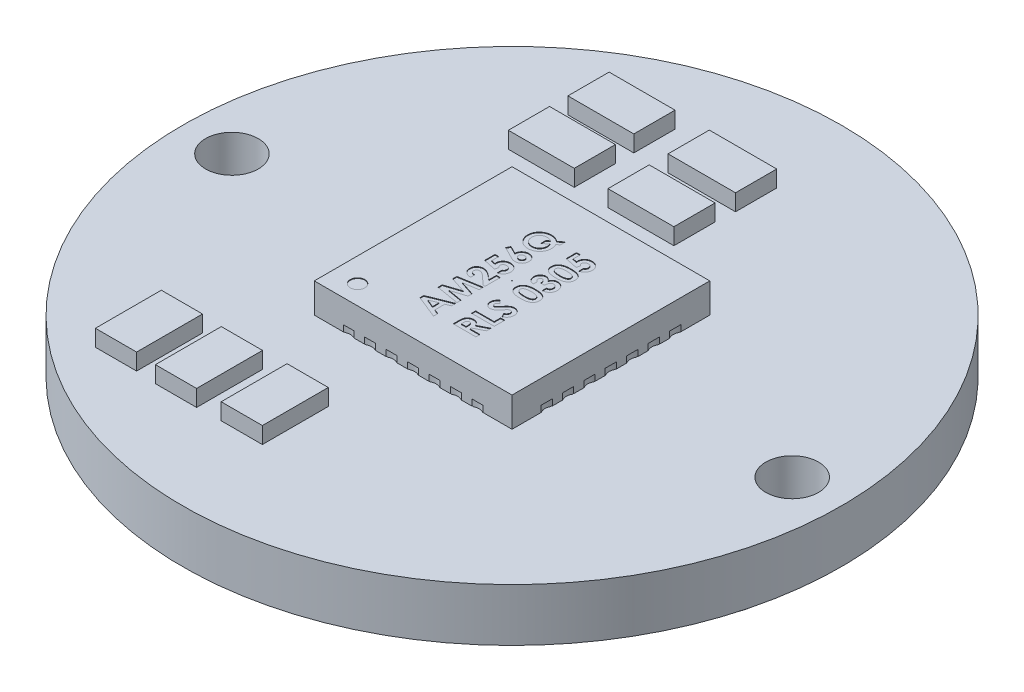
SolidWorks part; units mm, degrees
ref_plane "Plane1" through (0, 0, 0) normal (0, 0, 1) x (1, 0, 0)
ref_plane "Plane2" through (0, 0, 0) normal (0, 1, 0) x (1, 0, 0)
ref_plane "Plane3" through (0, 0, 0) normal (1, 0, 0) x (0, 0, -1)
sketch "Sketch1" plane through (0, 0, 0) normal (0, 1, 0) x (1, 0, 0)
  line L0 (0, 6) -> (6, 0) construction
  line L1 (0, 0) -> (6, 0)
  line L2 (0, 0) -> (0, 6)
  line L3 (0, 6) -> (6, 6)
  line L4 (6, 0) -> (6, 6)
  line L5 (6, 6) -> (0, 0) construction
  circle A0 centre (3, 3) radius 0.0106
  dimension "D1" = 6
  dimension "D2" = 6
extrude "Base-Extrude" add sketch "Sketch1" along normal blind 0.9
sketch "Sketch2" plane through (0, 0, 0) normal (0, -1, 0) x (1, 0, 0)
  line L0 (0.8008, -0.8) -> (5.2008, -0.8)
  line L1 (5.2008, -0.8) -> (5.2008, -5.2)
  line L2 (5.2008, -5.2) -> (0.8008, -5.2)
  line L3 (0.8008, -5.2) -> (0.8008, -0.8)
  line L4 (6, 0) -> (6, -6) construction
  line L5 (0, 0) -> (6, 0) construction
  line L6 (0.0008, -3.5) -> (0.5008, -3.5)
  line L7 (0.5008, -3.5) -> (0.5008, -3.8)
  line L8 (0.5008, -3.8) -> (0.0008, -3.8)
  line L9 (0.0008, -3.8) -> (0.0008, -3.5)
  line L11 (1.8508, -6) -> (1.8508, -5.5)
  line L12 (1.8508, -5.5) -> (1.5508, -5.5)
  line L13 (1.5508, -5.5) -> (1.5508, -6)
  line L14 (1.5508, -6) -> (1.8508, -6)
  line L15 (1.2008, -6) -> (1.2008, -5.5)
  line L16 (1.2008, -5.5) -> (0.9008, -5.5)
  line L17 (0.9008, -5.5) -> (0.9008, -6)
  line L18 (0.9008, -6) -> (1.2008, -6)
  line L19 (0.0008, -4.8) -> (0.5008, -4.8)
  line L20 (0.5008, -4.8) -> (0.5008, -5.1)
  line L21 (0.5008, -5.1) -> (0.0008, -5.1)
  line L22 (0.0008, -5.1) -> (0.0008, -4.8)
  line L23 (0.0008, -4.15) -> (0.5008, -4.15)
  line L24 (0.5008, -4.15) -> (0.5008, -4.45)
  line L25 (0.5008, -4.45) -> (0.0008, -4.45)
  line L26 (0.0008, -4.45) -> (0.0008, -4.15)
  line L27 (5.47, -0.1167) -> (5.87, -0.1167)
  line L28 (5.87, -0.1167) -> (5.87, -0.5167)
  line L29 (5.87, -0.5167) -> (5.47, -0.5167)
  line L30 (5.47, -0.5167) -> (5.47, -0.1167)
  line L31 (0.9008, 0) -> (1.2008, 0)
  line L32 (0.9008, -0.5) -> (0.9008, 0)
  line L33 (1.2008, 0) -> (1.2008, -0.5)
  line L34 (1.2008, -0.5) -> (0.9008, -0.5)
  line L35 (1.5508, 0) -> (1.8508, 0)
  line L36 (1.5508, -0.5) -> (1.5508, 0)
  line L37 (1.8508, 0) -> (1.8508, -0.5)
  line L38 (1.8508, -0.5) -> (1.5508, -0.5)
  line L39 (0.0008, -0.9) -> (0.5008, -0.9)
  line L40 (0.5008, -0.9) -> (0.5008, -1.2)
  line L41 (0.5008, -1.2) -> (0.0008, -1.2)
  line L42 (0.0008, -1.2) -> (0.0008, -0.9)
  line L43 (0.0008, -1.55) -> (0.5008, -1.55)
  line L44 (0.5008, -1.55) -> (0.5008, -1.85)
  line L45 (0.5008, -1.85) -> (0.0008, -1.85)
  line L46 (0.0008, -1.85) -> (0.0008, -1.55)
  line L47 (0.0008, -2.2) -> (0.5008, -2.2)
  line L48 (0.5008, -2.2) -> (0.5008, -2.5)
  line L49 (0.5008, -2.5) -> (0.0008, -2.5)
  line L50 (0.0008, -2.5) -> (0.0008, -2.2)
  line L51 (0.0008, -2.85) -> (0.5008, -2.85)
  line L52 (0.5008, -2.85) -> (0.5008, -3.15)
  line L53 (0.5008, -3.15) -> (0.0008, -3.15)
  line L54 (0.0008, -3.15) -> (0.0008, -2.85)
  line L55 (5.5008, -3.5) -> (5.5008, -3.8)
  line L56 (6.0008, -3.8) -> (6.0008, -3.5)
  line L58 (5.5008, -3.8) -> (6.0008, -3.8)
  line L59 (5.5008, -4.15) -> (5.5008, -4.45)
  line L60 (6.0008, -4.15) -> (5.5008, -4.15)
  line L61 (5.5008, -4.45) -> (6.0008, -4.45)
  line L62 (6.0008, -4.45) -> (6.0008, -4.15)
  line L63 (5.5008, -4.8) -> (5.5008, -5.1)
  line L64 (6.0008, -4.8) -> (5.5008, -4.8)
  line L65 (5.5008, -5.1) -> (6.0008, -5.1)
  line L66 (6.0008, -5.1) -> (6.0008, -4.8)
  line L67 (3.8008, -6) -> (3.8008, -5.5)
  line L68 (3.8008, -5.5) -> (3.5008, -5.5)
  line L69 (3.5008, -5.5) -> (3.5008, -6)
  line L70 (3.5008, -6) -> (3.8008, -6)
  line L71 (4.4508, -6) -> (4.4508, -5.5)
  line L72 (4.4508, -5.5) -> (4.1508, -5.5)
  line L73 (4.1508, -5.5) -> (4.1508, -6)
  line L74 (4.1508, -6) -> (4.4508, -6)
  line L75 (5.1008, -6) -> (5.1008, -5.5)
  line L76 (5.1008, -5.5) -> (4.8008, -5.5)
  line L77 (4.8008, -5.5) -> (4.8008, -6)
  line L78 (4.8008, -6) -> (5.1008, -6)
  line L79 (3.1508, -6) -> (3.1508, -5.5)
  line L80 (3.1508, -5.5) -> (2.8508, -5.5)
  line L81 (2.8508, -5.5) -> (2.8508, -6)
  line L82 (2.8508, -6) -> (3.1508, -6)
  line L83 (2.5008, -6) -> (2.5008, -5.5)
  line L84 (2.5008, -5.5) -> (2.2008, -5.5)
  line L85 (2.2008, -5.5) -> (2.2008, -6)
  line L86 (2.2008, -6) -> (2.5008, -6)
  line L87 (6.0008, -0.9) -> (5.5008, -0.9)
  line L88 (6.0008, -3.15) -> (6.0008, -2.85)
  line L89 (5.5008, -3.15) -> (6.0008, -3.15)
  line L90 (6.0008, -2.85) -> (5.5008, -2.85)
  line L91 (5.5008, -2.85) -> (5.5008, -3.15)
  line L92 (5.5008, -2.2) -> (5.5008, -2.5)
  line L93 (6.0008, -2.2) -> (5.5008, -2.2)
  line L94 (5.5008, -2.5) -> (6.0008, -2.5)
  line L95 (6.0008, -2.5) -> (6.0008, -2.2)
  line L96 (5.5008, -1.55) -> (5.5008, -1.85)
  line L97 (6.0008, -1.55) -> (5.5008, -1.55)
  line L98 (5.5008, -1.85) -> (6.0008, -1.85)
  line L99 (6.0008, -1.85) -> (6.0008, -1.55)
  line L100 (5.5008, -1.2) -> (6.0008, -1.2)
  line L101 (6.0008, -3.5) -> (5.5008, -3.5)
  line L102 (5.5008, -0.9) -> (5.5008, -1.2)
  line L103 (6.0008, -1.2) -> (6.0008, -0.9)
  line L104 (2.2008, 0) -> (2.5008, 0)
  line L105 (2.2008, -0.5) -> (2.2008, 0)
  line L106 (2.5008, 0) -> (2.5008, -0.5)
  line L107 (2.5008, -0.5) -> (2.2008, -0.5)
  line L108 (4.8008, 0) -> (5.1008, 0)
  line L109 (4.8008, -0.5) -> (4.8008, 0)
  line L110 (5.1008, 0) -> (5.1008, -0.5)
  line L111 (5.1008, -0.5) -> (4.8008, -0.5)
  line L112 (4.1508, 0) -> (4.4508, 0)
  line L113 (4.1508, -0.5) -> (4.1508, 0)
  line L114 (4.4508, 0) -> (4.4508, -0.5)
  line L115 (4.4508, -0.5) -> (4.1508, -0.5)
  line L116 (3.5008, 0) -> (3.8008, 0)
  line L117 (3.5008, -0.5) -> (3.5008, 0)
  line L118 (3.8008, 0) -> (3.8008, -0.5)
  line L119 (3.8008, -0.5) -> (3.5008, -0.5)
  line L120 (2.8508, -0.5) -> (2.8508, 0)
  line L121 (3.1508, 0) -> (3.1508, -0.5)
  line L122 (2.8508, 0) -> (3.1508, 0)
  line L123 (3.1508, -0.5) -> (2.8508, -0.5)
  circle A0 centre (3, -3) radius 0.005
  dimension "D2" = 3
  dimension "D3" = 0.01
  dimension "D1" = 3
extrude "Boss-Extrude1" add sketch "Sketch2" along normal blind 0.01
sketch "Sketch3" plane through (0, -0.01, 0) normal (0, -1, 0) x (1, 0, 0)
  line L3 (3.1508, 0) -> (3.5008, 0) construction
  circle A0 centre (4.9459, 0.25) radius 0.3
  circle A1 centre (4.2959, 0.25) radius 0.3
  circle A2 centre (3.6459, 0.25) radius 0.3
  circle A3 centre (2.9959, 0.25) radius 0.3
  circle A4 centre (2.3459, 0.25) radius 0.3
  circle A5 centre (1.6959, 0.25) radius 0.3
  circle A6 centre (1.0459, 0.25) radius 0.3
  circle A7 centre (4.9459, -6.25) radius 0.3
  circle A8 centre (4.2959, -6.25) radius 0.3
  circle A9 centre (3.6459, -6.25) radius 0.3
  circle A10 centre (2.9959, -6.25) radius 0.3
  circle A11 centre (2.3459, -6.25) radius 0.3
  circle A12 centre (1.6959, -6.25) radius 0.3
  circle A13 centre (1.0459, -6.25) radius 0.3
  circle A14 centre (-0.2541, -1.05) radius 0.3
  circle A15 centre (6.2459, -1.7) radius 0.3
  circle A16 centre (6.2459, -1.05) radius 0.3
  circle A17 centre (-0.2541, -1.7) radius 0.3
  circle A18 centre (6.2459, -2.35) radius 0.3
  circle A19 centre (-0.2541, -2.35) radius 0.3
  circle A20 centre (6.2459, -3) radius 0.3
  circle A21 centre (-0.2541, -3) radius 0.3
  circle A22 centre (6.2459, -3.65) radius 0.3
  circle A23 centre (-0.2541, -3.65) radius 0.3
  circle A24 centre (6.2459, -4.3) radius 0.3
  circle A25 centre (-0.2541, -4.3) radius 0.3
  circle A26 centre (6.2459, -4.95) radius 0.3
  circle A27 centre (-0.2541, -4.95) radius 0.3
  dimension "D1" = 0.6
  dimension "D2" = 0.25
extrude "Cut-Extrude1" cut sketch "Sketch3" against normal blind 0.2
sketch "Sketch4" plane through (0, 0.9, 0) normal (0, 1, 0) x (-1, 0, 0)
  line L0 (-2.7336, -0.3587) -> (-2.7336, -5.3322) construction
  text T0 "AM256Q  RLS 0305" font "Century Gothic" height 0.6879
extrude "Cut-Extrude2" cut sketch "Sketch4" against normal blind 0.02
sketch "Sketch5" plane through (0, 0.9, 0) normal (0, 1, 0) x (-1, 0, 0)
  circle A0 centre (-0.7301, -0.5825) radius 0.22
extrude "Cut-Extrude3" cut sketch "Sketch5" against normal blind 0.02
sketch "Sketch6" plane through (0, -0.01, 0) normal (0, -1, 0) x (1, 0, 0)
  line L0 (6, -5.1219) -> (6, -6) construction
  line L1 (4.5, -1.5) -> (1.5, -1.5)
  line L2 (4.5, -1.5) -> (4.5, -4.5)
  line L3 (4.5, -4.5) -> (1.5, -4.5)
  line L4 (1.5, -1.5) -> (1.5, -4.5)
  line L5 (0.8801, -6) -> (0, -6) construction
  dimension "D1" = 3
  dimension "D2" = 3
  dimension "D3" = 1.5
  dimension "D4" = 1.5
extrude "Cut-Extrude4" cut sketch "Sketch6" against normal blind 0.55
sketch "Sketch7" plane through (0, -0.01, 0) normal (0, -1, 0) x (1, 0, 0)
  line L1 (5.2008, -0.8) -> (0.8008, -0.8)
  line L2 (5.2008, -0.8) -> (5.2008, -5.2)
  line L3 (5.2008, -5.2) -> (0.8008, -5.2)
  line L4 (0.8008, -0.8) -> (0.8008, -5.2)
extrude "Boss-Extrude2" add sketch "Sketch7" against normal blind 0.3
sketch "Sketch9" plane through (0, -0.01, 0) normal (0, -1, 0) x (1, 0, 0)
  line L4 (0.8008, -0.8) -> (5.2008, -5.2) construction
  line L5 (5.2008, -0.8) -> (0.8008, -5.2) construction
  line L6 (3.0008, -3) -> (-5.4992, -3) construction
  line L7 (3.0008, -3) -> (11.5008, -3) construction
  circle A0 centre (3.0008, -3) radius 10
  circle A1 centre (-5.4992, -3) radius 0.8
  circle A2 centre (11.5008, -3) radius 0.8
  dimension "D2" = 8.5
  dimension "D3" = 8.5
  dimension "D4" = 1.6
  dimension "D5" = 1.6
extrude "Boss-Extrude3" add sketch "Sketch9" along normal blind 1.6
sketch "Sketch11" plane through (0, -1.61, 0) normal (0, -1, 0) x (1, 0, 0)
  line L0 (-5.4992, -0.75) -> (-5.4992, -5.25) construction
  line L1 (-4.3492, -0.75) -> (-4.3492, -5.25)
  line L2 (-6.6492, -0.75) -> (-6.6492, -5.25)
  line L3 (11.5008, -0.75) -> (11.5008, -5.25) construction
  line L4 (-0.6292, -7.6) -> (0.1708, -7.6)
  line L5 (-1.8992, -7.6) -> (-1.0992, -7.6)
  line L6 (-1.8992, -7.6) -> (-1.8992, -10.1)
  line L7 (-1.8992, -10.1) -> (-1.0992, -10.1)
  line L8 (-1.0992, -7.6) -> (-1.0992, -10.1)
  line L9 (-0.6292, -7.6) -> (-0.6292, -10.1)
  line L10 (-0.6292, -10.1) -> (0.1708, -10.1)
  line L11 (0.1708, -7.6) -> (0.1708, -10.1)
  line L12 (0.6408, -7.6) -> (1.4408, -7.6)
  line L13 (0.6408, -7.6) -> (0.6408, -10.1)
  line L14 (0.6408, -10.1) -> (1.4408, -10.1)
  line L15 (1.4408, -7.6) -> (1.4408, -10.1)
  line L16 (1.9108, -7.6) -> (2.7108, -7.6)
  line L17 (1.9108, -7.6) -> (1.9108, -10.1)
  line L18 (1.9108, -10.1) -> (2.7108, -10.1)
  line L19 (2.7108, -7.6) -> (2.7108, -10.1)
  line L20 (3.1808, -7.6) -> (3.9808, -7.6)
  line L21 (3.1808, -7.6) -> (3.1808, -10.1)
  line L22 (3.1808, -10.1) -> (3.9808, -10.1)
  line L23 (3.9808, -7.6) -> (3.9808, -10.1)
  line L24 (4.4508, -7.6) -> (5.2508, -7.6)
  line L25 (4.4508, -7.6) -> (4.4508, -10.1)
  line L26 (4.4508, -10.1) -> (5.2508, -10.1)
  line L27 (5.2508, -7.6) -> (5.2508, -10.1)
  line L28 (12.6508, -0.75) -> (12.6508, -5.25)
  line L29 (10.3508, -0.75) -> (10.3508, -5.25)
  circle A0 centre (-5.4992, -3) radius 0.8
  circle A1 centre (11.5008, -3) radius 0.8
  arc A2 (-4.3492, -0.75) -> (-6.6492, -0.75) centre (-5.4992, -0.75) ccw
  arc A3 (-6.6492, -5.25) -> (-4.3492, -5.25) centre (-5.4992, -5.25) ccw
  arc A4 (12.6508, -0.75) -> (10.3508, -0.75) centre (11.5008, -0.75) ccw
  arc A5 (10.3508, -5.25) -> (12.6508, -5.25) centre (11.5008, -5.25) ccw
  circle A10 centre (3.0008, -3) radius 10 construction
  point P9 (-5.4992, -3)
  point P40 (11.5008, -3)
  dimension "D1" = 2.3
  dimension "D2" = 2.3
  dimension "D3" = 4.1
  dimension "D5" = 4.6
  dimension "D4" = 0.8
  dimension "D6" = 2.5
  dimension "D8" = 4.5
  dimension "D9" = 4.5
  dimension "D7" = 6
extrude "Boss-Extrude5" add sketch "Sketch11" along normal blind 0.05
sketch "Sketch12" plane through (0, -0.01, 0) normal (0, 1, 0) x (1, 0, 0)
  line L0 (0.5762, 7.3118) -> (-1.4238, 7.3118)
  line L1 (3.6221, 7.2888) -> (1.6221, 7.2888)
  line L2 (3.6221, 7.2888) -> (3.6221, 8.5388)
  line L3 (3.6221, 8.5388) -> (1.6221, 8.5388)
  line L4 (1.6221, 7.2888) -> (1.6221, 8.5388)
  line L5 (0.5762, 7.3118) -> (0.5762, 8.5618)
  line L6 (0.5762, 8.5618) -> (-1.4238, 8.5618)
  line L7 (-1.4238, 7.3118) -> (-1.4238, 8.5618)
  line L8 (0.5762, 9.1191) -> (-1.4238, 9.1191)
  line L9 (0.5762, 9.1191) -> (0.5762, 10.3691)
  line L10 (0.5762, 10.3691) -> (-1.4238, 10.3691)
  line L11 (-1.4238, 9.1191) -> (-1.4238, 10.3691)
  line L12 (3.6653, 9.1153) -> (1.6194, 9.1153)
  line L13 (3.6653, 9.1153) -> (3.6653, 10.3653)
  line L14 (3.6653, 10.3653) -> (1.6194, 10.3653)
  line L15 (1.6194, 9.1153) -> (1.6194, 10.3653)
  line L16 (2.6033, -4.179) -> (1.3533, -4.179)
  line L21 (2.6033, -4.179) -> (2.6033, -2.179)
  line L22 (2.6033, -2.179) -> (1.3533, -2.179)
  line L23 (1.3533, -4.179) -> (1.3533, -2.179)
  line L24 (0.6307, -4.202) -> (-0.6193, -4.202)
  line L25 (0.6307, -4.202) -> (0.6307, -2.202)
  line L26 (0.6307, -2.202) -> (-0.6193, -2.202)
  line L27 (-0.6193, -4.202) -> (-0.6193, -2.202)
  line L28 (-1.2356, -4.156) -> (-2.4856, -4.156)
  line L29 (-1.2356, -4.156) -> (-1.2356, -2.156)
  line L30 (-1.2356, -2.156) -> (-2.4856, -2.156)
  line L31 (-2.4856, -4.156) -> (-2.4856, -2.156)
  dimension "D1" = 2
  dimension "D2" = 1.25
  dimension "D5" = 2
  dimension "D6" = 1.25
  dimension "D7" = 2
  dimension "D8" = 1.25
  dimension "D9" = 2
  dimension "D10" = 1.25
extrude "Boss-Extrude6" add sketch "Sketch12" along normal blind 0.5
sketch "Sketch13" plane through (0, -1.61, 0) normal (0, -1, 0) x (1, 0, 0)
  line L0 (-2.9587, -2.7677) -> (-1.7087, -2.7677)
  line L1 (-2.8753, 2.2592) -> (-1.6253, 2.2592)
  line L2 (-2.8753, 2.2592) -> (-2.8753, 0.2592)
  line L3 (-2.8753, 0.2592) -> (-1.6253, 0.2592)
  line L4 (-1.6253, 2.2592) -> (-1.6253, 0.2592)
  line L5 (-2.9587, -2.7677) -> (-2.9587, -4.7677)
  line L6 (-2.9587, -4.7677) -> (-1.7087, -4.7677)
  line L7 (-1.7087, -2.7677) -> (-1.7087, -4.7677)
  line L8 (6.5591, 1.9831) -> (8.5591, 1.9831)
  line L9 (6.5591, 3.7831) -> (8.5591, 3.7831)
  line L10 (6.5591, 3.7831) -> (6.5591, 2.5331)
  line L11 (6.5591, 2.5331) -> (8.5591, 2.5331)
  line L12 (8.5591, 3.7831) -> (8.5591, 2.5331)
  line L13 (6.5591, 1.9831) -> (6.5591, 0.7331)
  line L14 (6.5591, 0.7331) -> (8.5591, 0.7331)
  line L15 (8.5591, 1.9831) -> (8.5591, 0.7331)
  line L16 (6.5591, 0.1831) -> (8.5591, 0.1831)
  line L17 (6.5591, 0.1831) -> (6.5591, -1.0669)
  line L18 (6.5591, -1.0669) -> (8.5591, -1.0669)
  line L19 (8.5591, 0.1831) -> (8.5591, -1.0669)
  line L20 (6.5591, -1.6169) -> (8.5591, -1.6169)
  line L21 (6.5591, -1.6169) -> (6.5591, -2.8669)
  line L22 (6.5591, -2.8669) -> (8.5591, -2.8669)
  line L23 (8.5591, -1.6169) -> (8.5591, -2.8669)
  line L24 (6.5591, -3.4169) -> (8.5591, -3.4169)
  line L25 (6.5591, -3.4169) -> (6.5591, -4.6669)
  line L26 (6.5591, -4.6669) -> (8.5591, -4.6669)
  line L27 (8.5591, -3.4169) -> (8.5591, -4.6669)
  line L28 (6.5591, -5.2169) -> (8.5591, -5.2169)
  line L29 (6.5591, -5.2169) -> (6.5591, -6.4669)
  line L30 (6.5591, -6.4669) -> (8.5591, -6.4669)
  line L31 (8.5591, -5.2169) -> (8.5591, -6.4669)
  dimension "D1" = 1.25
  dimension "D2" = 2
  dimension "D3" = 2
  dimension "D4" = 1.25
  dimension "D5" = 6
extrude "Boss-Extrude7" add sketch "Sketch13" along normal blind 0.5
sketch "Sketch14" plane through (0, -1.61, 0) normal (0, -1, 0) x (1, 0, 0)
  line L1 (-0.8014, -5.4713) -> (2.1986, -5.4713)
  line L2 (-0.8014, -5.4713) -> (-0.8014, -6.9713)
  line L3 (-0.8014, -6.9713) -> (2.1986, -6.9713)
  line L4 (2.1986, -5.4713) -> (2.1986, -6.9713)
  dimension "D1" = 1.5
  dimension "D2" = 3
extrude "Boss-Extrude8" add sketch "Sketch14" along normal blind 1.8
sketch "Sketch15" plane through (0, -1.61, 0) normal (0, -1, 0) x (1, 0, 0)
  line L0 (0.709, 3.4224) -> (4.6927, 3.4224)
  line L204 (0.709, -5.0639) -> (0.709, -4.7639)
  line L205 (0.709, -4.3639) -> (0.709, -3.5139)
  line L206 (-0.407, -4.3639) -> (-0.407, -4.7639)
  line L207 (-0.407, -3.1139) -> (-0.407, -3.5139)
  line L208 (0.709, -3.1139) -> (0.709, -2.2639)
  line L209 (-0.407, -1.8639) -> (-0.407, -2.2639)
  line L210 (-0.407, -0.6139) -> (-0.407, -1.0139)
  line L211 (0.709, -1.8639) -> (0.709, -1.0139)
  line L212 (0.709, -0.6139) -> (0.709, 0.2361)
  line L213 (-0.407, 0.6361) -> (-0.407, 0.2361)
  line L214 (0.709, 0.6361) -> (0.709, 1.4861)
  line L215 (-0.407, 1.8861) -> (-0.407, 1.4861)
  line L216 (0.709, 1.8861) -> (0.709, 2.7361)
  line L217 (-0.407, 3.1361) -> (-0.407, 2.7361)
  line L218 (0.709, 3.1361) -> (0.709, 3.4224)
  line L219 (5.793, 3.1361) -> (5.793, 2.7361)
  line L220 (4.6927, 3.4224) -> (4.6927, 3.1361)
  line L221 (4.6927, 2.7361) -> (4.6927, 1.8861)
  line L222 (5.793, 1.8861) -> (5.793, 1.4861)
  line L223 (4.6927, 1.4861) -> (4.6927, 0.6361)
  line L224 (5.793, 0.6361) -> (5.793, 0.2361)
  line L225 (4.6927, 0.2361) -> (4.6927, -0.6139)
  line L226 (5.793, -0.6139) -> (5.793, -1.0139)
  line L227 (4.6927, -1.0139) -> (4.6927, -1.8639)
  line L228 (5.793, -1.8639) -> (5.793, -2.2639)
  line L229 (4.6927, -2.2639) -> (4.6927, -3.1139)
  line L230 (5.793, -3.1139) -> (5.793, -3.5139)
  line L231 (4.6927, -3.5139) -> (4.6927, -4.3639)
  line L232 (5.793, -4.3639) -> (5.793, -4.7639)
  line L233 (4.6927, -4.7639) -> (4.6927, -5.0639)
  line L235 (0.709, -0.6139) -> (-0.407, -0.6139)
  line L237 (0.709, -4.7639) -> (-0.407, -4.7639)
  line L238 (0.709, -4.3639) -> (-0.407, -4.3639)
  line L239 (-0.407, -3.5139) -> (0.709, -3.5139)
  line L241 (0.709, -3.1139) -> (-0.407, -3.1139)
  line L242 (-0.407, -2.2639) -> (0.709, -2.2639)
  line L243 (0.709, -1.8639) -> (-0.407, -1.8639)
  line L244 (-0.407, -1.0139) -> (0.709, -1.0139)
  line L245 (-0.407, 0.2361) -> (0.709, 0.2361)
  line L246 (4.6927, -5.0639) -> (0.709, -5.0639)
  line L247 (0.709, 0.6361) -> (-0.407, 0.6361)
  line L248 (-0.407, 1.4861) -> (0.709, 1.4861)
  line L250 (0.709, 1.8861) -> (-0.407, 1.8861)
  line L251 (-0.407, 2.7361) -> (0.709, 2.7361)
  line L252 (0.709, 3.1361) -> (-0.407, 3.1361)
  line L255 (4.6927, -4.7639) -> (5.793, -4.7639)
  line L257 (4.6927, -4.3639) -> (5.793, -4.3639)
  line L258 (5.793, -3.5139) -> (4.6927, -3.5139)
  line L259 (4.6927, -3.1139) -> (5.793, -3.1139)
  line L260 (5.793, -2.2639) -> (4.6927, -2.2639)
  line L261 (4.6927, -1.8639) -> (5.793, -1.8639)
  line L262 (5.793, -1.0139) -> (4.6927, -1.0139)
  line L263 (4.6927, -0.6139) -> (5.793, -0.6139)
  line L264 (5.793, 0.2361) -> (4.6927, 0.2361)
  line L265 (4.6927, 0.6361) -> (5.793, 0.6361)
  line L266 (5.793, 1.4861) -> (4.6927, 1.4861)
  line L267 (4.6927, 1.8861) -> (5.793, 1.8861)
  line L268 (5.793, 2.7361) -> (4.6927, 2.7361)
  line L269 (4.6927, 3.1361) -> (5.793, 3.1361)
  point P275 (-4.4855, 1.779)
extrude "Boss-Extrude9" add sketch "Sketch15" along normal blind 1.6
sketch "Sketch21" plane through (0, -3.21, 0) normal (0, -1, 0) x (1, 0, 0)
  circle A0 centre (1.5351, 2.4841) radius 0.3283
extrude "Cut-Extrude9" cut sketch "Sketch21" against normal blind 0.01
sketch "Sketch22" plane through (0, -3.41, 0) normal (0, -1, 0) x (1, 0, 0)
  line L1 (-0.2441, -5.3242) -> (-0.0857, -5.3242)
  line L2 (-0.2441, -5.3242) -> (-0.2441, -7.104)
  line L3 (-0.2441, -7.104) -> (-0.0857, -7.104)
  line L4 (-0.0857, -5.3242) -> (-0.0857, -7.104)
extrude "Cut-Extrude10" cut sketch "Sketch22" against normal blind 0.01
sketch "Sketch23" plane through (0, 0, 3.4224) normal (0, 0, 1) x (1, 0, 0)
  line L0 (-0.407, -1.787) -> (0, -1.787)
  line L1 (-0.407, -3.21) -> (-0.407, -1.61) construction
  line L2 (0, -1.787) -> (0.2939, -2.3001)
  line L3 (0.2939, -2.3001) -> (0.709, -2.3001)
  line L4 (0.709, -3.21) -> (0.709, -1.61) construction
  line L5 (0.709, -2.3001) -> (0.709, -2.8354)
  line L6 (0.709, -2.8354) -> (1.2085, -3.21)
  line L7 (4.6927, -3.21) -> (0.709, -3.21) construction
  line L8 (1.2085, -3.21) -> (1.2085, -4.0325)
  line L9 (1.2085, -4.0325) -> (-0.8883, -4.0325)
  line L10 (-0.8883, -4.0325) -> (-0.8883, -1.787)
  line L11 (-0.8883, -1.787) -> (-0.407, -1.787)
  line L12 (2.7009, -3.21) -> (2.7009, -2.5826) construction
  line L13 (6.2901, -4.0325) -> (6.2901, -1.787)
  line L14 (4.6927, -2.3001) -> (4.6927, -3.0139)
  line L15 (5.1078, -2.3001) -> (4.6927, -2.3001)
  line L16 (5.4017, -1.787) -> (5.1078, -2.3001)
  line L17 (5.8087, -1.787) -> (5.4017, -1.787)
  line L18 (6.2901, -1.787) -> (5.8087, -1.787)
  line L19 (4.6927, -3.21) -> (4.6927, -1.61) construction
  line L20 (4.6927, -3.0139) -> (4.4577, -3.21)
  line L21 (4.4577, -3.21) -> (4.4577, -4.0325)
  line L22 (4.4577, -4.0325) -> (6.2901, -4.0325)
  line L23 (0.0852, -1.61) -> (0.3823, -2.1435)
  line L24 (0.709, -1.61) -> (-0.407, -1.61) construction
  line L25 (0.3823, -2.1435) -> (0.709, -2.1435)
  line L26 (0.709, -3.21) -> (0.709, -1.61) construction
  line L27 (0.709, -2.1435) -> (0.709, -1.787)
  line L28 (0.709, -1.787) -> (0.8433, -1.662)
  line L29 (0.8433, -1.662) -> (4.5723, -1.662)
  line L30 (4.5723, -1.662) -> (4.6927, -1.7914)
  line L31 (4.6927, -3.21) -> (4.6927, -1.61) construction
  line L32 (4.6927, -1.7914) -> (4.6927, -2.1435)
  line L33 (4.6927, -2.1435) -> (5.0436, -2.1435)
  line L34 (5.0436, -2.1435) -> (5.3355, -1.61)
  line L35 (5.793, -1.61) -> (4.6927, -1.61) construction
  line L36 (5.3355, -1.61) -> (0.0852, -1.61)
extrude "Cut-Extrude11" cut sketch "Sketch23" against normal blind 8.6
